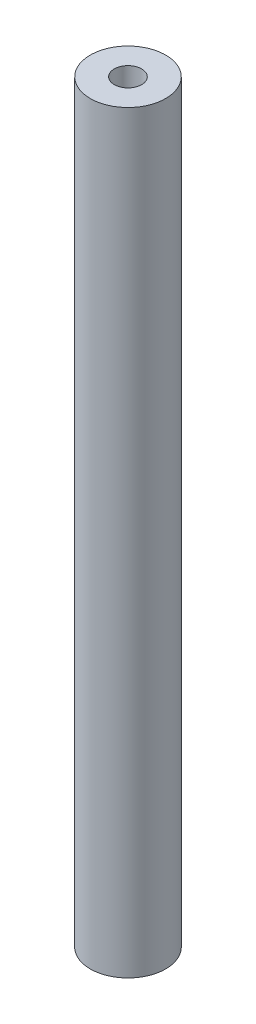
SolidWorks part; units mm, degrees
ref_plane "Front Plane" through (0, 0, 0) normal (0, 0, 1) x (1, 0, 0)
ref_plane "Top Plane" through (0, 0, 0) normal (0, 1, 0) x (1, 0, 0)
ref_plane "Right Plane" through (0, 0, 0) normal (1, 0, 0) x (0, 0, -1)
sketch "Sketch1" plane through (0, 0, 0) normal (0, 1, 0) x (1, 0, 0)
  circle A0 centre (0, 0) radius 4.7625
  dimension "D2" = 9.525
extrude "Boss-Extrude1" add sketch "Sketch1" along normal blind 95.25
hole_wizard "#8-32 Tapped Hole1" positions "Sketch3" profile "Sketch2" tap size "#8-32" standard "ANSI Inch"
sketch "Sketch3" plane through (0, 0, 0) normal (0, -1, 0) x (-1, 0, 0)
  circle A0 centre (0, 0) radius 4.7625 construction
  point P0 (0, 0)
sketch "Sketch2" plane through (0, 0, 0) normal (1, 0, 0) x (0, 0, -1)
  line L0 (0, 0) -> (0, 22.4754)
  line L1 (0, 22.4754) -> (1.7272, 21.4376)
  line L2 (1.7272, 21.4376) -> (1.7272, 0)
  line L5 (1.7272, 0) -> (0, 0)
  line L10 (0, 22.4754) -> (-1.7272, 21.4376) construction
  line L11 (0, -6.35) -> (0, 107.95) construction
  dimension "Tap Drill Dia." = 3.4544
  dimension "Tap Drill Depth" = 21.4376
  dimension "Drill Angle" = 118
hole_wizard "#8-32 Tapped Hole2" positions "Sketch4" profile "Sketch5" tap size "#8-32" standard "ANSI Inch"
sketch "Sketch4" plane through (0, 95.25, 0) normal (0, 1, 0) x (1, 0, 0)
  point P0 (0, 0)
sketch "Sketch5" plane through (0, 95.25, 0) normal (1, 0, 0) x (0, 0, 1)
  line L0 (0, 0) -> (0, 22.4754)
  line L1 (0, 22.4754) -> (1.7272, 21.4376)
  line L2 (1.7272, 21.4376) -> (1.7272, 0)
  line L5 (1.7272, 0) -> (0, 0)
  line L10 (0, 22.4754) -> (-1.7272, 21.4376) construction
  line L11 (0, -6.35) -> (0, 107.95) construction
  dimension "Tap Drill Dia." = 3.4544
  dimension "Tap Drill Depth" = 21.4376
  dimension "Drill Angle" = 118
